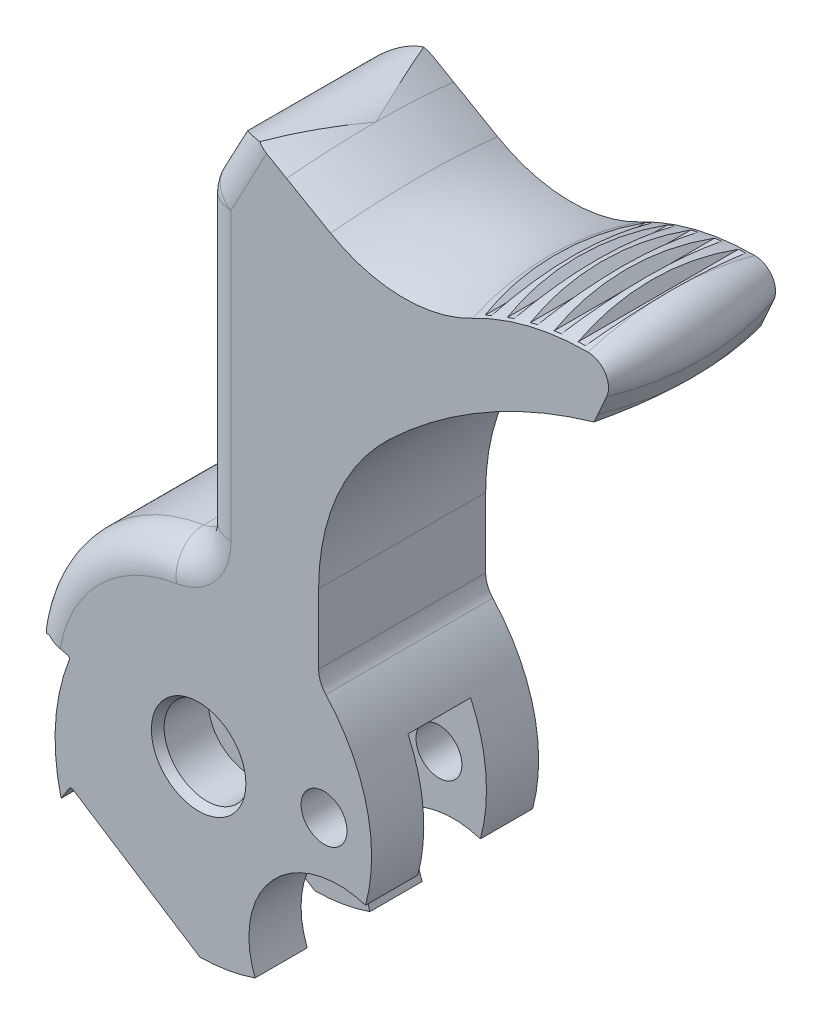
SolidWorks part; units mm, degrees
ref_plane "Front Plane" through (0, 0, 0) normal (0, 0, 1) x (1, 0, 0)
ref_plane "Top Plane" through (0, 0, 0) normal (0, 1, 0) x (1, 0, 0)
ref_plane "Right Plane" through (0, 0, 0) normal (1, 0, 0) x (0, 0, -1)
sketch "Sketch1" plane through (0, 0, 0) normal (0, 0, 1) x (1, 0, 0)
  line L0 (0, 0) -> (0, 22.0257) construction
  line L1 (0, 9.5309) -> (0, 23.3727)
  line L2 (0, 23.3727) -> (0.8992, 25.0639)
  line L3 (4.4119, 26.0711) -> (6.477, 24.8788)
  line L4 (0, 0) -> (-8.8874, -16.7147) construction
  line L5 (0, 0) -> (25.0837, 0) construction
  line L6 (5.6388, 9.652) -> (5.6388, 6.3711)
  line L7 (19.269, 23.0944) -> (19.6802, 24.0181)
  line L8 (0.0529, -8.1278) -> (-5.9042, -4.2961)
  line L9 (-6.0797, -4.3342) -> (-6.4626, -4.9294)
  line L10 (0, 0) -> (-9.1347, -14.2015) construction
  line L11 (0, 0) -> (17.7584, -11.4226) construction
  line L12 (14.839, 4.7057) -> (-3.2443, 1.5171) construction
  line L13 (-6.1715, 1.0598) -> (-7.0408, 1.2605)
  line L15 (-7.4361, 1.1113) -> (-7.7314, 1.1555)
  line L16 (0, 0) -> (-13.842, 3.1957) construction
  circle A0 centre (0, 0) radius 2.0002
  arc A1 (-1.2834, 8.026) -> (-7.9858, 1.5137) centre (0, 0) ccw
  arc A2 (0.8992, 25.0639) -> (4.4119, 26.0711) centre (3.1419, 23.8714) cw
  arc A3 (6.477, 24.8788) -> (12.6095, 24.7589) centre (9.652, 30.3781) ccw
  arc A4 (12.6095, 24.7589) -> (18.288, 26.162) centre (18.288, 13.97) cw
  arc A5 (18.288, 26.162) -> (19.6802, 24.0181) centre (18.288, 24.638) cw
  arc A6 (19.269, 23.0944) -> (8.948, 17.3756) centre (25.0673, 0.4572) ccw
  arc A7 (5.6388, 6.3711) -> (5.9752, 5.5101) centre (6.9088, 6.3711) ccw
  arc A8 (2.6521, -7.6832) -> (7.8453, -2.1252) centre (6.5786, -6.1468) cw
  circle A9 centre (5.8928, 0.4572) radius 1.0795
  arc A10 (8.948, 17.3756) -> (5.6388, 9.652) centre (16.3068, 9.652) ccw
  arc A11 (-6.0797, -4.3342) -> (-5.9042, -4.2961) centre (-5.9729, -4.4029) cw
  arc A12 (-6.0819, 0.8896) -> (-6.4626, -4.9294) centre (2.8294, -2.6154) ccw
  arc A13 (-6.0819, 0.8896) -> (-6.1715, 1.0598) centre (-6.2, 0.9361) ccw
  arc A14 (-7.9858, 1.5137) -> (-7.7314, 1.1555) centre (-7.6863, 1.4569) ccw
  arc A15 (-7.0408, 1.2605) -> (-7.4361, 1.1113) centre (-7.1265, 0.8893) ccw
  arc A16 (0.0529, -8.1278) -> (2.6521, -7.6832) centre (0, 0) ccw
  arc A17 (7.8453, -2.1252) -> (5.9752, 5.5101) centre (0, 0) ccw
  arc A18 (0, 9.5309) -> (-1.2834, 8.026) centre (-1.524, 9.5309) cw
  point P47 (0, 8.128)
  point P50 (-6.0268, 1.0264)
  dimension "D1" = 4.0005
  dimension "D2" = 16.256
  dimension "D3" = 23.368
  dimension "D4" = 6.35
  dimension "D5" = 2.54
  dimension "D6" = 12.192
  dimension "D7" = 1.524
  dimension "D9" = 1.27
  dimension "D10" = 4.2164
  dimension "D15" = 2.159
  dimension "D18" = 10.668
  dimension "D29" = 0.127
  dimension "D30" = 9.5758
  dimension "D38" = 0.127
  dimension "D39" = 0.3048
  dimension "D40" = 0.381
  dimension "D35" = 1.524
  dimension "D8" = 60
  dimension "D11" = 28
  dimension "D12" = 10.9728
  dimension "D13" = 6.5786
  dimension "D14" = 6.1468
  dimension "D16" = 5.8928
  dimension "D17" = 0.4572
  dimension "D19" = 13.97
  dimension "D20" = 9.652
  dimension "D21" = 9.652
  dimension "D22" = 24
  dimension "D23" = 5.6388
  dimension "D24" = 18.288
  dimension "D25" = 32.75
  dimension "D26" = 2.7686
  dimension "D27" = 32.75
  dimension "D28" = 6.8072
  dimension "D31" = 10
  dimension "D32" = 2.0574
  dimension "D33" = 13
  dimension "D34" = 0.3556
  dimension "D37" = 8.5
extrude "Boss-Extrude1" add sketch "Sketch1" along normal mid plane 7.8486
ref_plane "Plane1" through (-7.9802, 4.6074, 0) normal (0.866, -0.5, 0) x (0, 0, -1)
ref_plane "Plane2" through (-12.3796, 7.1474, 0) normal (0.866, -0.5, 0) x (0, 0, -1)
sketch "Sketch8" plane through (-13.6141, 5.0091, 0) normal (-0.866, 0.5, 0) x (0, 0, 1)
  line L1 (3.9243, 27.2533) -> (-3.9243, 27.2533) construction
  line L2 (-4.8521, 26.4001) -> (-4.7782, 27.8482)
  line L3 (-4.7782, 27.8482) -> (4.9138, 27.6092)
  line L4 (4.9138, 27.6092) -> (4.8521, 26.4001)
  arc A0 (-4.8521, 26.4001) -> (4.8521, 26.4001) centre (0, 13.0293) cw
  dimension "D1" = 14.224
sketch "Sketch10" plane through (0, 0, 3.9243) normal (0, 0, 1) x (1, 0, 0)
  line L0 (6.477, 24.8788) -> (4.4119, 26.0711) construction
  line L1 (19.269, 23.0944) -> (19.6802, 24.0181) construction
  line L2 (6.477, 24.8788) -> (4.4119, 26.0711)
  line L3 (19.269, 23.0944) -> (19.6802, 24.0181)
  line L4 (4.4119, 26.0711) -> (-0.0866, 28.6683)
  line L5 (19.269, 23.0944) -> (17.2636, 18.5903)
  arc A1 (6.477, 24.8788) -> (12.6095, 24.7589) centre (9.652, 30.3781) ccw construction
  arc A2 (18.288, 26.162) -> (12.6095, 24.7589) centre (18.288, 13.97) ccw construction
  arc A3 (19.6802, 24.0181) -> (18.288, 26.162) centre (18.288, 24.638) ccw construction
  arc A5 (6.477, 24.8788) -> (12.6095, 24.7589) centre (9.652, 30.3781) ccw
  arc A6 (18.288, 26.162) -> (12.6095, 24.7589) centre (18.288, 13.97) ccw
  arc A7 (19.6802, 24.0181) -> (18.288, 26.162) centre (18.288, 24.638) ccw
sweep "Cut-Sweep3" cut profiles "Sketch8" path "Sketch10"
sketch "Sketch3" plane through (0, 0, -3.9243) normal (0, 0, -1) x (-1, 0, 0)
  line L0 (-18.288, 27.2776) -> (-18.288, 14.7664) construction
  line L1 (-18.288, 14.7664) -> (-12.2913, 25.153) construction
  line L2 (-18.288, 26.162) -> (-18.0181, 25.6509)
  line L3 (-17.368, 26.1272) -> (-17.6757, 25.6379)
  line L4 (-17.1049, 26.1045) -> (-16.8859, 25.5696)
  line L5 (-16.1926, 25.9806) -> (-16.5463, 25.5235)
  line L6 (-15.9329, 25.9324) -> (-15.7668, 25.3788)
  line L7 (-15.037, 25.7206) -> (-15.4334, 25.2999)
  line L8 (-14.7832, 25.6474) -> (-14.6716, 25.0803)
  line L9 (-13.912, 25.3496) -> (-14.3474, 24.9694)
  line L10 (-13.6666, 25.2522) -> (-13.6105, 24.6769)
  line L11 (-12.8284, 24.8713) -> (-13.2986, 24.5351)
  line L12 (-15.5998, 25.3406) -> (-15.3909, 26.2243) construction
  line L13 (-17.8469, 25.6457) -> (-17.7977, 26.9456) construction
  arc A0 (-18.0181, 25.6509) -> (-17.6757, 25.6379) centre (-18.288, 13.97) cw
  arc A3 (-12.8284, 24.8713) -> (-13.6666, 25.2522) centre (-18.288, 13.97) ccw
  arc A4 (-16.8859, 25.5696) -> (-16.5463, 25.5235) centre (-18.288, 13.97) cw
  arc A5 (-17.368, 26.1272) -> (-18.288, 26.162) centre (-18.288, 13.97) ccw
  arc A6 (-15.7668, 25.3788) -> (-15.4334, 25.2999) centre (-18.288, 13.97) cw
  arc A7 (-16.1926, 25.9806) -> (-17.1049, 26.1045) centre (-18.288, 13.97) ccw
  arc A8 (-14.6716, 25.0803) -> (-14.3474, 24.9694) centre (-18.288, 13.97) cw
  arc A9 (-15.037, 25.7206) -> (-15.9329, 25.9324) centre (-18.288, 13.97) ccw
  arc A10 (-13.6105, 24.6769) -> (-13.2986, 24.5351) centre (-18.288, 13.97) cw
  arc A11 (-13.912, 25.3496) -> (-14.7832, 25.6474) centre (-18.288, 13.97) ccw
  dimension "D2" = 11.684
  dimension "D1" = 30
  dimension "D3" = 60
  dimension "D4" = 30
  dimension "D5" = 5
extrude "Cut-Extrude1" cut sketch "Sketch3" against normal blind 7.8486
sketch "Sketch4" plane through (0, 0, 0) normal (0, 0, 1) x (1, 0, 0)
  line L0 (10.5067, 3.9418) -> (-13.7914, -0.3427)
  line L1 (196976.3896, 34734.3412) -> (-196964.7949, -34728.1185) construction
  spline S0 degree 2 poles (10.5067, 3.9418) (4.8534, -21.7048) (-13.7914, -0.3427) knots 0 0 0 1 1 1
extrude "Cut-Extrude2" cut sketch "Sketch4" against normal mid plane 2.9464
sketch "Sketch5" plane through (0, 0, 0) normal (1, 0, 0) x (0, 0, -1)
  line L0 (3.9243, 2.2202) -> (3.5433, 2.0002)
  line L1 (3.9243, -2.1252) -> (3.9243, 5.5101) construction
  line L2 (0, 0) -> (0, 9.3464) construction
  line L4 (0, 0) -> (8.6499, 0) construction
  line L5 (3.9243, 2.2202) -> (3.9243, 2.0002)
  line L6 (3.9243, -2.0002) -> (3.9243, 2.0002) construction
  line L7 (3.9243, 2.0002) -> (3.5433, 2.0002)
  line L8 (-3.9243, 2.0002) -> (-3.5433, 2.0002)
  line L9 (-3.9243, 2.2202) -> (-3.9243, 2.0002)
  line L10 (-3.9243, 2.2202) -> (-3.5433, 2.0002)
  dimension "D2" = 30
  dimension "D3" = 0.381
  dimension "D5" = 2.0002
revolve "Cut-Revolve1" cut sketch "Sketch5" angle 360 about L4
fillet "Fillet2" radius 1.524 1 edges at (0, 23.3727, 0)
fillet "Fillet3" radius 1.524 10 edges at (0.5388, 24.386, 3.9243) (0.0453, 23.3614, 3.9243) (-5.6641, 5.8294, 3.9243) (-0.3644, 8.542, 3.9243) (0.5388, 24.386, -3.9243) (0.0453, 23.3614, -3.9243) (-5.6641, 5.8294, -3.9243) (-0.3644, 8.542, -3.9243) (0, 16.2618, 3.9243) (0, 16.2618, -3.9243)
